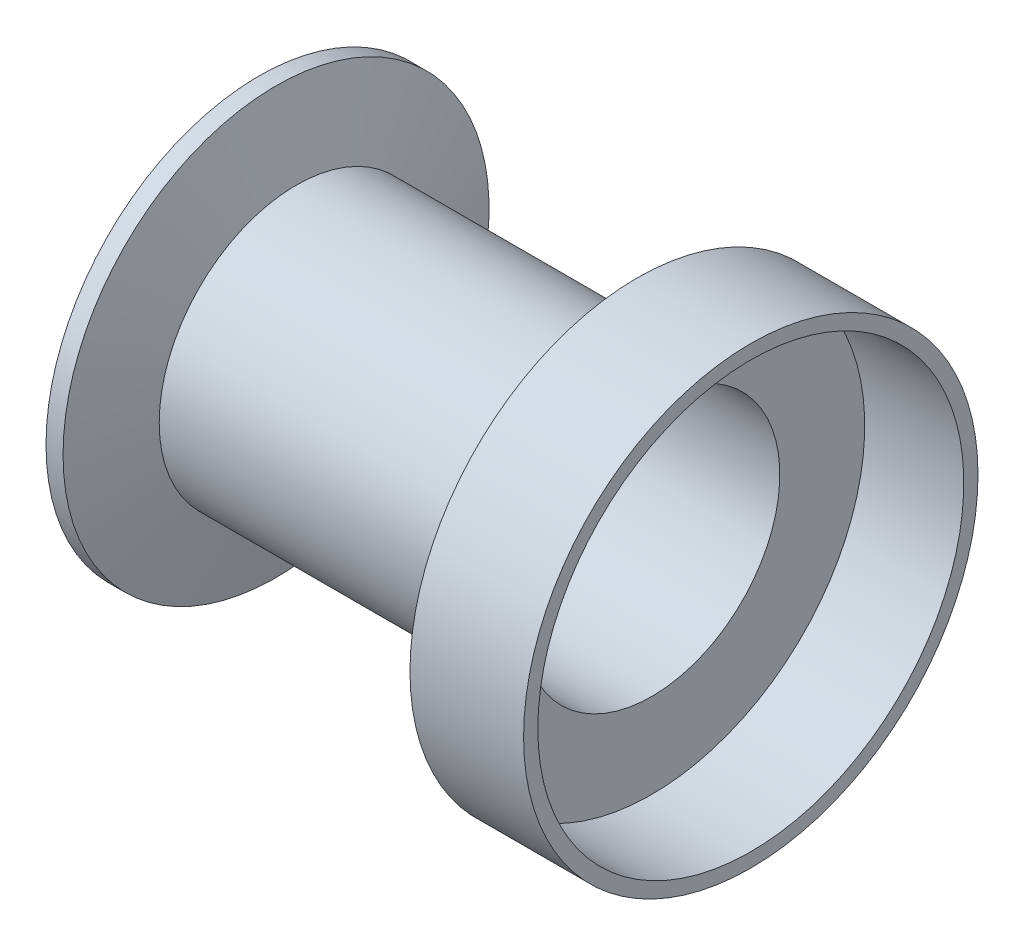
SolidWorks part; units mm, degrees
ref_plane "Plan de face" through (0, 0, 0) normal (0, 0, 1) x (1, 0, 0)
ref_plane "Plan de dessus" through (0, 0, 0) normal (0, 1, 0) x (1, 0, 0)
ref_plane "Plan de droite" through (0, 0, 0) normal (1, 0, 0) x (0, 0, -1)
sketch "Esquisse2" plane through (0, 0, 0) normal (0, 0, 1) x (1, 0, 0)
  line L0 (0, 0) -> (93.8406, 0) construction
  line L1 (0, 26.15) -> (0, 37.5)
  line L2 (0, 37.5) -> (3, 37.5)
  line L3 (3, 37.5) -> (6.58, 24.15)
  line L4 (6.58, 24.15) -> (66.58, 24.15)
  line L5 (0, 26.15) -> (2.5, 26.15)
  line L6 (2.5, 26.15) -> (2.5, 22.55)
  line L7 (2.5, 22.55) -> (69.14, 22.55)
  line L8 (66.58, 24.15) -> (66.58, 40)
  line L9 (66.58, 40) -> (86.58, 40)
  line L10 (86.58, 40) -> (86.58, 37.5)
  line L11 (86.58, 37.5) -> (69.14, 37.5)
  line L12 (69.14, 37.5) -> (69.14, 22.55)
  dimension "D1" = 75
  dimension "D2" = 3
  dimension "D3" = 3.58
  dimension "D4" = 48.3
  dimension "D5" = 52.3
  dimension "D6" = 2.5
  dimension "D7" = 45.1
  dimension "D8" = 80
  dimension "D9" = 60
  dimension "D10" = 20
  dimension "D11" = 2.56
  dimension "D12" = 2.5
revolve "Révolution1" add sketch "Esquisse2" angle 360 about L0
